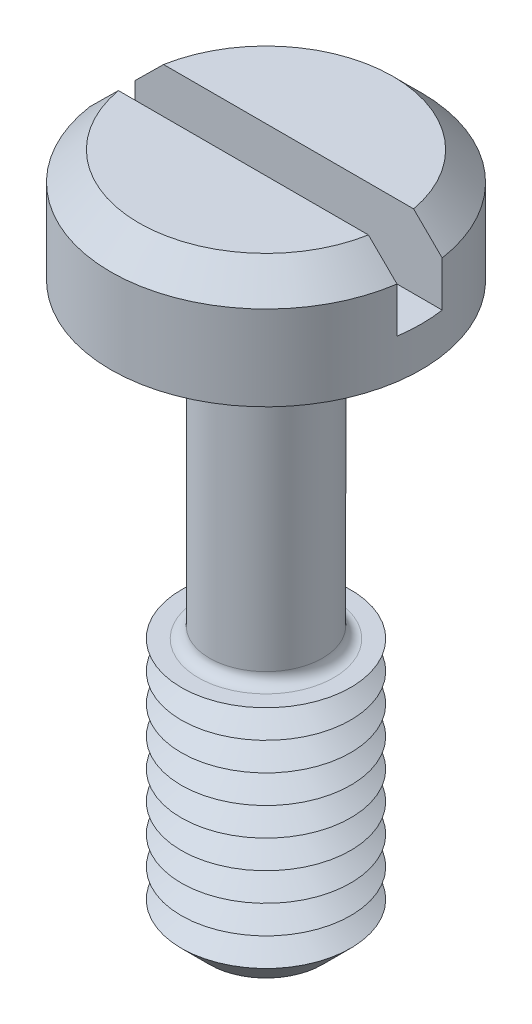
SolidWorks part; units mm, degrees
ref_plane "Front Plane" through (0, 0, 0) normal (0, 0, 1) x (1, 0, 0)
ref_plane "Top Plane" through (0, 0, 0) normal (0, 1, 0) x (1, 0, 0)
ref_plane "Right Plane" through (0, 0, 0) normal (1, 0, 0) x (0, 0, -1)
sketch "Sketch1" plane through (0, 0, 0) normal (0, 1, 0) x (1, 0, 0)
  circle A0 centre (0, 0) radius 2.75
  dimension "D1" = 5.5
extrude "Boss-Extrude1" add sketch "Sketch1" along normal blind 2
sketch "Sketch2" plane through (0, 0, 0) normal (0, -1, 0) x (1, 0, 0)
  circle A0 centre (0, 0) radius 1
  dimension "D1" = 2
extrude "Boss-Extrude2" add sketch "Sketch2" along normal blind 10
sketch "Sketch3" plane through (0, -10, 0) normal (0, -1, 0) x (1, 0, 0)
  circle A0 centre (0, 0) radius 1.5
  dimension "D1" = 3
extrude "Boss-Extrude3" add sketch "Sketch3" against normal blind 4.5
chamfer "Chamfer1" distance 0.5 angle 45 1 edges at (0, -10, -1.5)
sketch "Sketch4" plane through (0, 0, 0) normal (1, 0, 0) x (0, 0, -1)
  line L0 (0, -6.5871) -> (0, -12.0372) construction
sketch "Sketch5" plane through (0, 0, 0) normal (1, 0, 0) x (0, 0, -1)
  line L0 (-1.5, -5.5) -> (-1.067, -5.75)
  line L1 (-1.067, -5.75) -> (-1.5, -6)
  line L2 (-1.5, -5.5) -> (-1.5, -9.5) construction
  line L3 (-1.5, -6) -> (-1.5, -5.5)
  dimension "D1" = 0.5
revolve "Cut-Revolve1" cut sketch "Sketch5" angle 360 about L0
pattern_linear "LPattern1" count 8 spacing 0.5 along (0, -1, 0) of "Cut-Revolve1"
fillet "Fillet1" radius 0.2 2 edges at (0, -5.5, -1) (0, 0, -1)
chamfer "Chamfer2" distance 0.5 angle 45 1 edges at (0, 2, 2.75)
sketch "Sketch6" plane through (0, 2, 0) normal (0, 1, 0) x (1, 0, 0)
  line L1 (2.75, -0.4) -> (-2.75, -0.4)
  line L2 (2.75, -0.4) -> (2.75, 0.4)
  line L3 (2.75, 0.4) -> (-2.75, 0.4)
  line L4 (-2.75, -0.4) -> (-2.75, 0.4)
  line L5 (2.75, -0.4) -> (-2.75, 0.4) construction
  line L6 (2.75, 0.4) -> (-2.75, -0.4) construction
  circle A0 centre (0, 0) radius 2.75 construction
  point P0 (0, 0)
  dimension "D1" = 0.8
extrude "Cut-Extrude1" cut sketch "Sketch6" against normal blind 1.3
